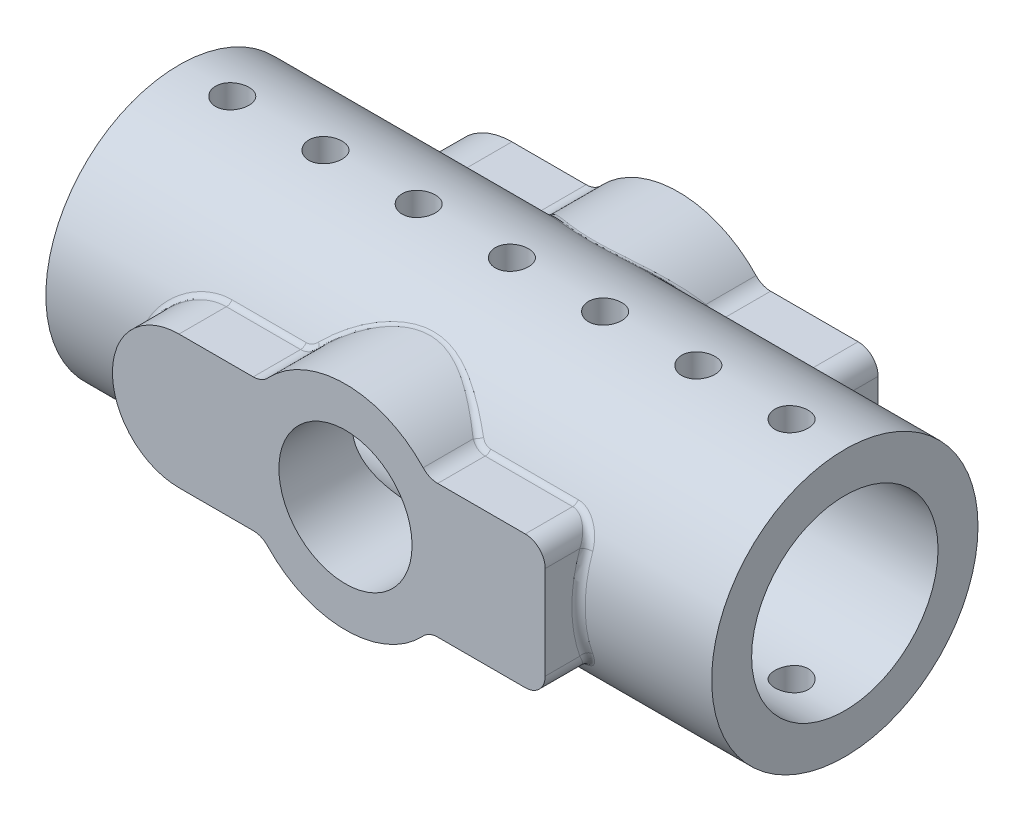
SolidWorks part; units mm, degrees
ref_plane "Front Plane" through (0, 0, 0) normal (0, 0, 1) x (1, 0, 0)
ref_plane "Top Plane" through (0, 0, 0) normal (0, 1, 0) x (1, 0, 0)
ref_plane "Right Plane" through (0, 0, 0) normal (1, 0, 0) x (0, 0, -1)
sketch "Sketch1" plane through (0, 0, 0) normal (1, 0, 0) x (0, 0, -1)
  circle A0 centre (0, 0) radius 20
  dimension "D1" = 40
extrude "Boss-Extrude1" add sketch "Sketch1" against normal mid plane 100
sketch "Sketch2" plane through (0, 0, 0) normal (0, 0, 1) x (1, 0, 0)
  line L0 (13.8564, 10) -> (27, 10)
  line L1 (-25, -10) -> (-13.8564, -10)
  line L2 (-25, 0) -> (30, 0) construction
  line L3 (-25, 10) -> (-13.8564, 10)
  line L4 (30, -7) -> (30, 7)
  line L7 (13.8564, -10) -> (27, -10)
  arc A0 (-11.6686, -10.9474) -> (11.6686, -10.9474) centre (0, 0) ccw
  arc A1 (11.6686, 10.9474) -> (-11.6686, 10.9474) centre (0, 0) ccw
  arc A2 (11.6686, -10.9474) -> (13.8564, -10) centre (13.8564, -13) cw
  arc A3 (-11.6686, -10.9474) -> (-13.8564, -10) centre (-13.8564, -13) ccw
  arc A4 (-13.8564, 10) -> (-11.6686, 10.9474) centre (-13.8564, 13) ccw
  arc A5 (11.6686, 10.9474) -> (13.8564, 10) centre (13.8564, 13) ccw
  arc A6 (27, -10) -> (30, -7) centre (27, -7) ccw
  arc A7 (27, 10) -> (30, 7) centre (27, 7) cw
  arc A8 (-25, 10) -> (-25, -10) centre (-25, 0) ccw
  point P12 (12.49, -10)
  point P19 (12.49, 10)
  dimension "D2" = 16
  dimension "D4" = 3
  dimension "D5" = 10
  dimension "D1" = 55
  dimension "D3" = 30
  dimension "D6" = 20
extrude "Boss-Extrude2" add sketch "Sketch2" along normal mid plane 50
sketch "Sketch4" plane through (50, 0, 0) normal (1, 0, 0) x (0, 0, -1)
  circle A0 centre (0, 0) radius 14
  circle A1 centre (0, 0) radius 20 construction
  dimension "D1" = 28
extrude "Cut-Extrude1" cut sketch "Sketch4" against normal through all
sketch "Sketch3" plane through (0, 0, 0) normal (0, 1, 0) x (1, 0, 0)
  line L0 (-50, 20) -> (-50, -20) construction
  circle A0 centre (-42, 0) radius 2.5
  circle A1 centre (-28, 0) radius 2.5
  circle A2 centre (-14, 0) radius 2.5
  circle A3 centre (0, 0) radius 2.5
  circle A4 centre (14, 0) radius 2.5
  circle A5 centre (28, 0) radius 2.5
  circle A6 centre (42, 0) radius 2.5
  dimension "D1" = 5
  dimension "D2" = 8
  dimension "D3" = 7
extrude "Cut-Extrude2" cut sketch "Sketch3" against normal through all and the other way through all
sketch "Sketch5" plane through (0, 0, 25) normal (0, 0, 1) x (1, 0, 0)
  circle A0 centre (0, 0) radius 10
  dimension "D1" = 20
extrude "Cut-Extrude3" cut sketch "Sketch5" against normal through all
fillet "Fillet1" radius 1 28 edges at (28.3714, 9.6682, 17.5079) (29.5379, 8.5998, -18.0567) (30, 0, 20) (30, 0, -20) (29.5379, -8.5998, 18.0567) (28.3714, -9.6682, -17.5079) (20.4282, -10, 17.3205) (20.4282, -10, -17.3205) (13.2878, -10.0544, 17.289) (12.5355, -10.3065, -17.1399) (0.6285, -15.9877, 12.0164) (-1.3191, -15.9455, -12.0723) (-12.5684, -10.2906, 17.1495) (-13.3174, -10.0488, -17.2922) (-19.4282, -10, 17.3205) (-19.4282, -10, -17.3205) (-15.051, -1.0091, 19.9745) (-15.051, 1.0091, -19.9745) (-19.4282, 10, 17.3205) (-19.4282, 10, -17.3205) (-13.3174, 10.0488, 17.2922) (-12.5684, 10.2906, -17.1495) (-1.3191, 15.9455, 12.0723) (0.6285, 15.9877, -12.0164) (12.5355, 10.3065, 17.1399) (13.2878, 10.0544, -17.289) (20.4282, 10, 17.3205) (20.4282, 10, -17.3205)
sketch "Sketch6" [suppressed] plane through (0, 0, 25) normal (0, 0, 1) x (1, 0, 0)
  circle A0 centre (-25, 0) radius 5
  dimension "D1" = 10
extrude "Cut-Extrude4" [suppressed] cut sketch "Sketch6" against normal through all
